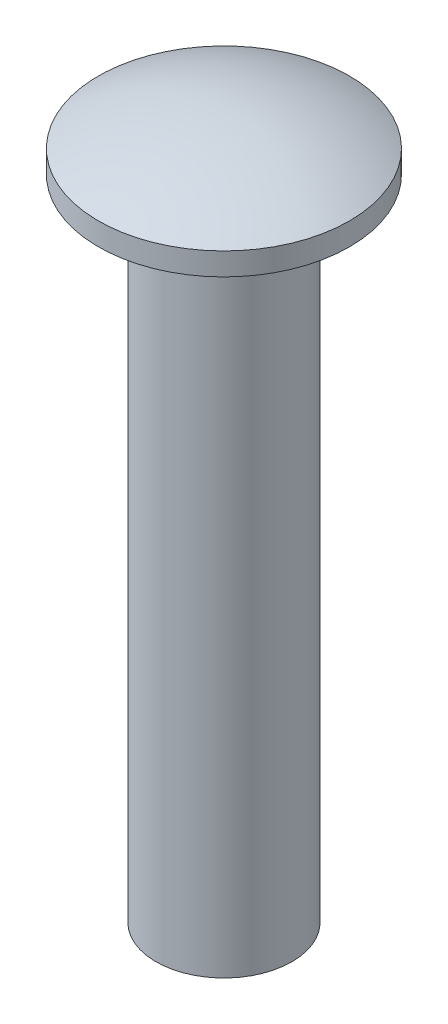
SolidWorks part; units mm, degrees
ref_plane "Front Plane" through (0, 0, 0) normal (0, 0, 1) x (1, 0, 0)
ref_plane "Top Plane" through (0, 0, 0) normal (0, 1, 0) x (1, 0, 0)
ref_plane "Right Plane" through (0, 0, 0) normal (1, 0, 0) x (0, 0, -1)
sketch "Sketch1" plane through (0, 0, 0) normal (0, 0, 1) x (1, 0, 0)
  line L0 (0, 0) -> (0, 14.2875) construction
  line L1 (0, 14.2875) -> (2.7686, 14.2875) construction
  line L2 (0, 14.2875) -> (0, 15.4875) construction
  line L3 (2.7686, 14.2875) -> (1.4986, 14.2875)
  line L4 (1.4986, 14.2875) -> (1.4986, 0)
  line L5 (1.4986, 0) -> (1.0795, 0)
  line L6 (1.0795, 0) -> (1.0795, 1.2126)
  line L7 (1.0795, 1.2126) -> (0, 1.6597)
  line L9 (0, 1.6597) -> (0, 15.4875)
  line L10 (2.7686, 14.2875) -> (2.7686, 14.7837)
  line L11 (0, 15.4875) -> (-1.1513, 15.4875) construction
  arc A0 (0, 15.4875) -> (2.7686, 14.7837) centre (0, 9.6902) cw
  point P14 (2.1336, 14.2875)
  dimension "D1" = 1.4986
  dimension "D4" = 67.5
  dimension "D2" = 14.2875
  dimension "D3" = 2.7686
  dimension "D5" = 1.0795
  dimension "D6" = 1.2
revolve "Revolve1" add sketch "Sketch1" angle 360 about L9
